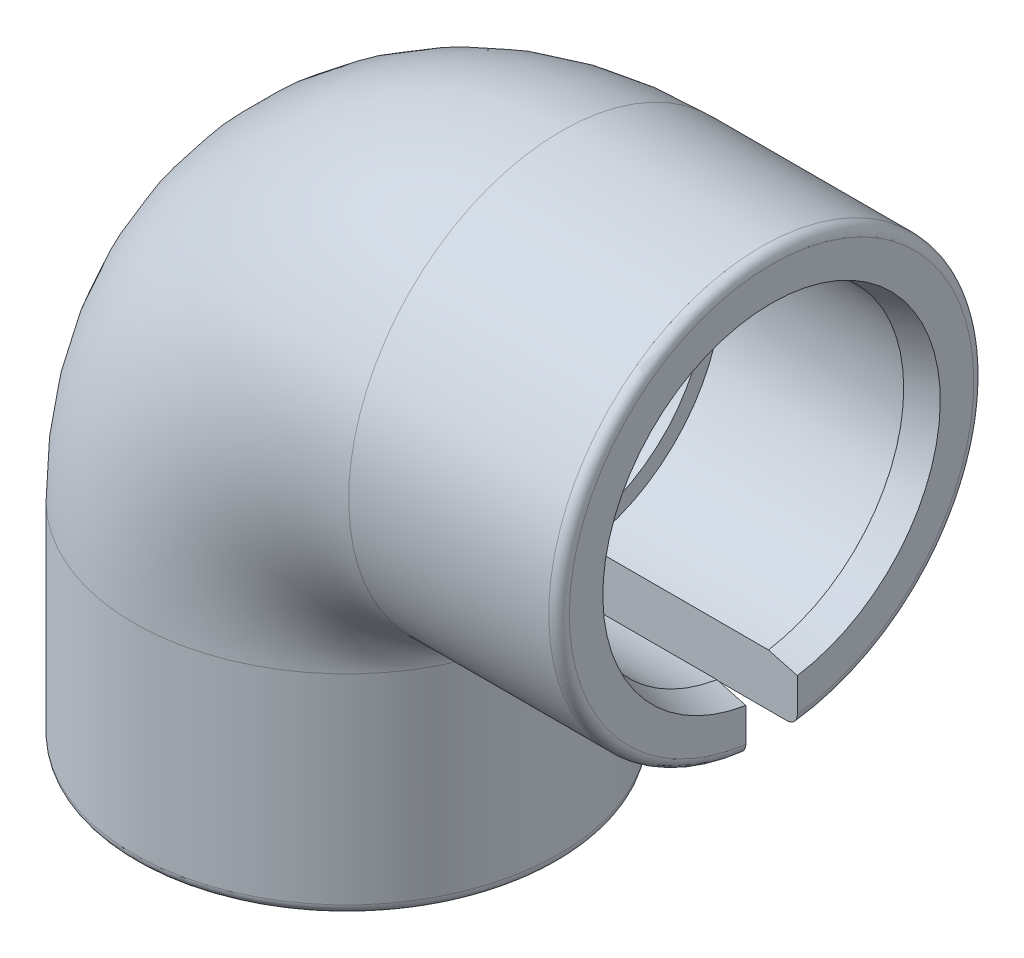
SolidWorks part; units mm, degrees
ref_plane "Front Plane" through (0, 0, 0) normal (0, 0, 1) x (1, 0, 0)
ref_plane "Top Plane" through (0, 0, 0) normal (0, 1, 0) x (1, 0, 0)
ref_plane "Right Plane" through (0, 0, 0) normal (1, 0, 0) x (0, 0, -1)
imported_body "Importée3"
sketch "Esquisse1" plane through (0, 0, 0) normal (0, -1, 0) x (1, 0, 0)
  circle A0 centre (-16.665, 0) radius 12.5
  circle A1 centre (-16.665, 0) radius 16.5
extrude "Boss.-Extru.1" add sketch "Esquisse1" along normal blind 16.335
chamfer "Chanfrein1" distance 0.6 angle 75 2 edges at (-16.665, -16.335, -12.5) (16.335, 16.665, 12.5)
fillet "Congé1" radius 0.8 2 edges at (16.335, 16.665, 16.5) (-16.665, -16.335, -16.5)
sketch "Esquisse2" plane through (0, 0, 0) normal (0, 1, 0) x (1, 0, 0)
  line L1 (-3.3448, 2) -> (21.0736, 2)
  line L2 (-3.3448, 2) -> (-3.3448, -2)
  line L3 (-3.3448, -2) -> (21.0736, -2)
  line L4 (21.0736, 2) -> (21.0736, -2)
  point P5 (-3.3448, 0)
  dimension "D1" = 4
extrude "Enlèv. mat.-Extru.1" cut sketch "Esquisse2" along normal up to next
